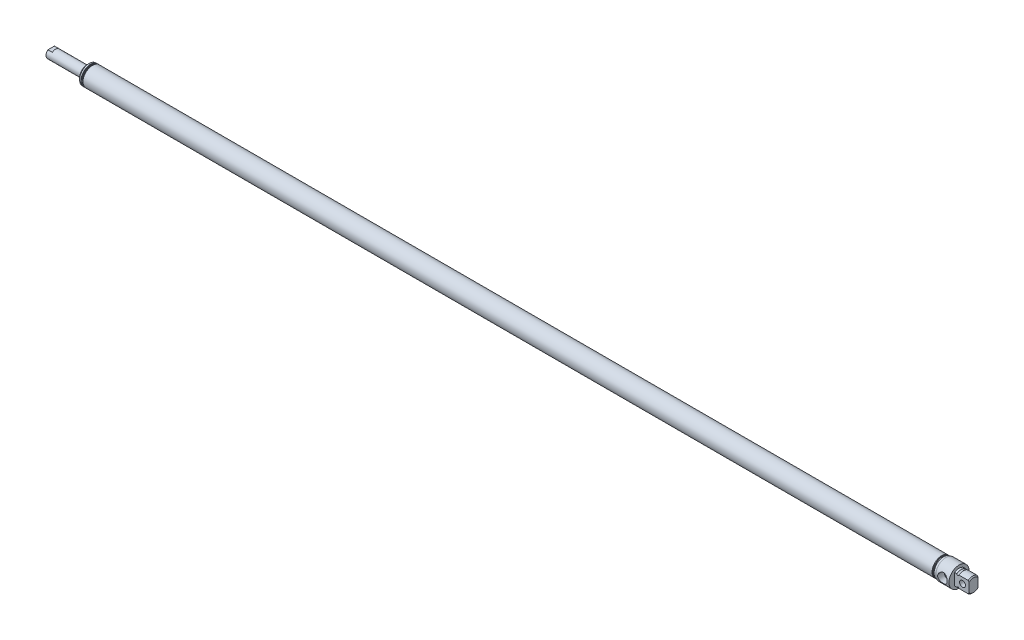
SolidWorks part; units mm, degrees
ref_plane "Front" through (0, 0, 0) normal (0, 0, 1) x (1, 0, 0)
ref_plane "Top" through (0, 0, 0) normal (0, 1, 0) x (1, 0, 0)
ref_plane "Right" through (0, 0, 0) normal (1, 0, 0) x (0, 0, -1)
sketch "Sketch2" plane through (0, 0, 0) normal (0, 0, 1) x (1, 0, 0)
  line L0 (974.725, 10.287) -> (45.974, 10.287)
  line L1 (43.688, 7.9375) -> (45.974, 7.9375)
  line L2 (43.688, 7.9375) -> (43.688, 5.5562)
  line L3 (45.974, 10.287) -> (45.974, 7.9375)
  line L4 (974.725, 10.922) -> (974.725, 10.287)
  line L5 (988.949, 50) -> (988.949, -50) construction
  line L6 (-12.192, 0) -> (777.8115, 0) construction
  line L7 (988.949, 0) -> (988.949, 10.922)
  line L8 (-21.4174, 0) -> (23.0483, 0) construction
  line L9 (974.725, 10.922) -> (988.949, 10.922)
  line L10 (43.688, 5.5562) -> (4.826, 5.5562)
  line L11 (4.826, 5.5562) -> (4.826, 0)
  line L12 (4.826, 10.287) -> (4.826, -10.287) construction
  line L13 (4.826, 0) -> (988.949, 0)
  line L17 (50, 0) -> (-50, 0) construction
  line L18 (988.949, 10.287) -> (988.949, -10.287) construction
  line L19 (45.974, 50) -> (45.974, -50) construction
  dimension "D1" = 15.875
  dimension "D2" = 2.286
  dimension "D3" = 14.224
  dimension "D4" = 21.844
  dimension "D5" = 11.1125
revolve "Base-Revolve" add sketch "Sketch2" angle 360 about L8
sketch "Sketch6" plane through (0, 0, 0) normal (0, 0, 1) x (1, 0, 0)
  line L0 (0, 0) -> (-63.9853, 0) construction
  line L1 (45.974, 0) -> (988.949, 0) construction
  line L2 (790.5115, 0) -> (790.5115, 9.525)
  line L3 (790.5115, 9.525) -> (244.4115, 9.525)
  line L4 (244.4115, 9.525) -> (244.4115, 3.175)
  line L5 (244.4115, 3.175) -> (4.826, 3.175)
  line L6 (4.826, 3.175) -> (4.826, 0)
  line L7 (4.826, 0) -> (790.5115, 0)
  line L8 (790.5115, 10.287) -> (790.5115, -10.287) construction
  line L9 (4.826, 5.5562) -> (4.826, -5.5562) construction
  line L10 (244.4115, 10.287) -> (244.4115, -10.287) construction
  line L11 (50, 0) -> (-50, 0) construction
  dimension "D1" = 6.35
  dimension "D2" = 19.05
revolve "Cavity" cut sketch "Sketch6" angle 360 about L0
sketch "Sketch8" plane through (988.949, 0, 0) normal (1, 0, 0) x (0, 0, -1)
  circle A0 centre (0, 0) radius 7.9375
  dimension "D1" = 15.875
extrude "Boss-Extrude1" add sketch "Sketch8" along normal offset from surface (15.748 mm away) 7.112
sketch "Sketch11" plane through (0, 0, 0) normal (0, 0, 1) x (1, 0, 0)
  line L0 (0, 0) -> (161.0301, 0) construction
  line L1 (988.949, -7.9375) -> (1004.697, -7.9375) construction
  line L2 (988.949, -10.287) -> (988.949, 10.287) construction
  line L3 (991.362, -7.9375) -> (993.648, -7.9375)
  arc A0 (993.648, -7.9375) -> (991.362, -7.9375) centre (992.505, -8.4911) ccw
  dimension "D2" = 1.27
  dimension "D1" = 2.286
  dimension "D3" = 2.286
revolve "Cut-Revolve3" cut sketch "Sketch11" angle 360 about L0
sketch "Sketch9" plane through (1004.697, 0, 0) normal (1, 0, 0) x (0, 0, -1)
  line L0 (-4.826, 6.3019) -> (-4.826, -6.3019)
  line L1 (4.826, 6.3019) -> (4.826, -6.3019)
  line L2 (0, 0) -> (0, 6.2016) construction
  circle A0 centre (0, 0) radius 7.9375 construction
  arc A1 (4.826, -6.3019) -> (4.826, 6.3019) centre (0, 0) ccw
  arc A2 (-4.826, 6.3019) -> (-4.826, -6.3019) centre (0, 0) ccw
  dimension "D1" = 9.652
extrude "Cut-Extrude1" cut sketch "Sketch9" against normal up to surface (15.748 mm away)
sketch "Sketch10" plane through (0, 0, 4.826) normal (0, 0, 1) x (1, 0, 0)
  line L0 (997.585, 33.9884) -> (997.585, -33.9884) construction
  circle A0 centre (997.585, 0) radius 3.175
  dimension "D1" = 6.35
extrude "0.25 Dia Pin Hole" cut sketch "Sketch10" against normal up to surface (9.652 mm away)
sketch "Sketch3" plane through (0, 0, 0) normal (0, 0, 1) x (1, 0, 0)
  line L0 (47.498, 10.287) -> (47.498, 9.398)
  line L1 (47.498, 9.398) -> (48.387, 10.287)
  line L2 (48.387, 10.287) -> (47.498, 10.287)
  line L3 (974.725, 10.287) -> (45.974, 10.287) construction
  line L4 (48.768, 10.287) -> (48.768, 9.398)
  line L5 (48.768, 9.398) -> (49.657, 10.287)
  line L6 (49.657, 10.287) -> (48.768, 10.287)
  line L7 (45.974, 10.287) -> (45.974, -10.287) construction
  line L15 (0, 0) -> (35.6608, 0) construction
  line L16 (50, 0) -> (-50, 0) construction
  circle A0 centre (48.133, 9.398) radius 0.635 construction
  dimension "D1" = 1.27
  dimension "D2" = 0.889
  dimension "D3" = 1.524
revolve "Cut-Revolve1" cut sketch "Sketch3" angle 360 about L15
sketch "Sketch12" plane through (0, 0, 0) normal (0, 0, 1) x (1, 0, 0)
  line L0 (159.7602, 0) -> (101.9804, 0) construction
  line L1 (991.362, 0) -> (988.949, 0) construction
  line L2 (970.026, 10.287) -> (970.915, 9.398)
  line L3 (970.915, 9.398) -> (970.915, 10.287)
  line L4 (970.915, 10.287) -> (970.026, 10.287)
  line L5 (971.296, 10.287) -> (972.185, 9.398)
  line L6 (972.185, 9.398) -> (972.185, 10.287)
  line L7 (972.185, 10.287) -> (971.296, 10.287)
  line L8 (974.725, 10.922) -> (974.725, -10.922) construction
  dimension "D1" = 0.889
  dimension "D2" = 1.27
  dimension "D3" = 2.54
  dimension "D4" = 20.574
revolve "Cut-Revolve4" cut sketch "Sketch12" angle 360 about L0
sketch "Sketch15" plane through (4.826, 0, 0) normal (-1, 0, 0) x (0, 0, 1)
  line L0 (-3.4967, -4.318) -> (3.4967, -4.318)
  line L1 (-3.4967, 4.318) -> (3.4967, 4.318)
  circle A0 centre (0, 0) radius 5.5562 construction
  arc A1 (-3.4967, -4.318) -> (3.4967, -4.318) centre (0, 0) ccw
  arc A2 (3.4967, 4.318) -> (-3.4967, 4.318) centre (0, 0) ccw
  dimension "D1" = 8.636
extrude "Wrench Flats" cut sketch "Sketch15" against normal blind 4.826
ref_plane "Plane2" through (981.837, 0, 10.922) normal (0, 0, 1) x (0, 1, 0)
hole_wizard "1/8 NPT REAR SIDE PORT" positions "Sketch14" profile "Sketch13" size "1/8" standard "Ansi Inch"
sketch "Sketch14" plane through (981.837, 0, 10.922) normal (0, 0, 1) x (0, 1, 0)
  line L0 (0, 981.837) -> (0, 820.8069) construction
  point P0 (0, 0)
  dimension "D1" = 15.748
sketch "Sketch13" plane through (981.837, 0, 10.922) normal (1, 0, 0) x (0, -1, 0)
  line L0 (0, 0) -> (0, 14.1565)
  line L1 (4.2164, 11.623) -> (0, 14.1565)
  line L2 (-4.2164, 11.623) -> (0, 14.1565) construction
  line L3 (4.2164, 11.623) -> (4.2164, 6.924)
  line L4 (4.2164, 6.924) -> (4.9362, 6.924)
  line L5 (4.9362, 6.924) -> (5.1435, 0)
  line L6 (-4.9362, 6.924) -> (-5.1435, 0) construction
  line L7 (5.1435, 0) -> (0, 0)
  line L8 (0, -6.35) -> (0, 107.95) construction
  line L11 (-4.2164, 6.924) -> (-4.9362, 6.924) construction
  dimension "Tap Drill Dia." = 8.4328
  dimension "Tap Drill Depth" = 11.623
  dimension "Thread Dia." = 10.287
  dimension "Thread Angle" = 3.43
  dimension "Thread Depth" = 6.924
  dimension "Drill Angle" = 118
chamfer "Chamfer1" distance 1.016 angle 45 2 edges at (1004.697, 7.9375, 0) (1004.697, -7.9375, 0)
